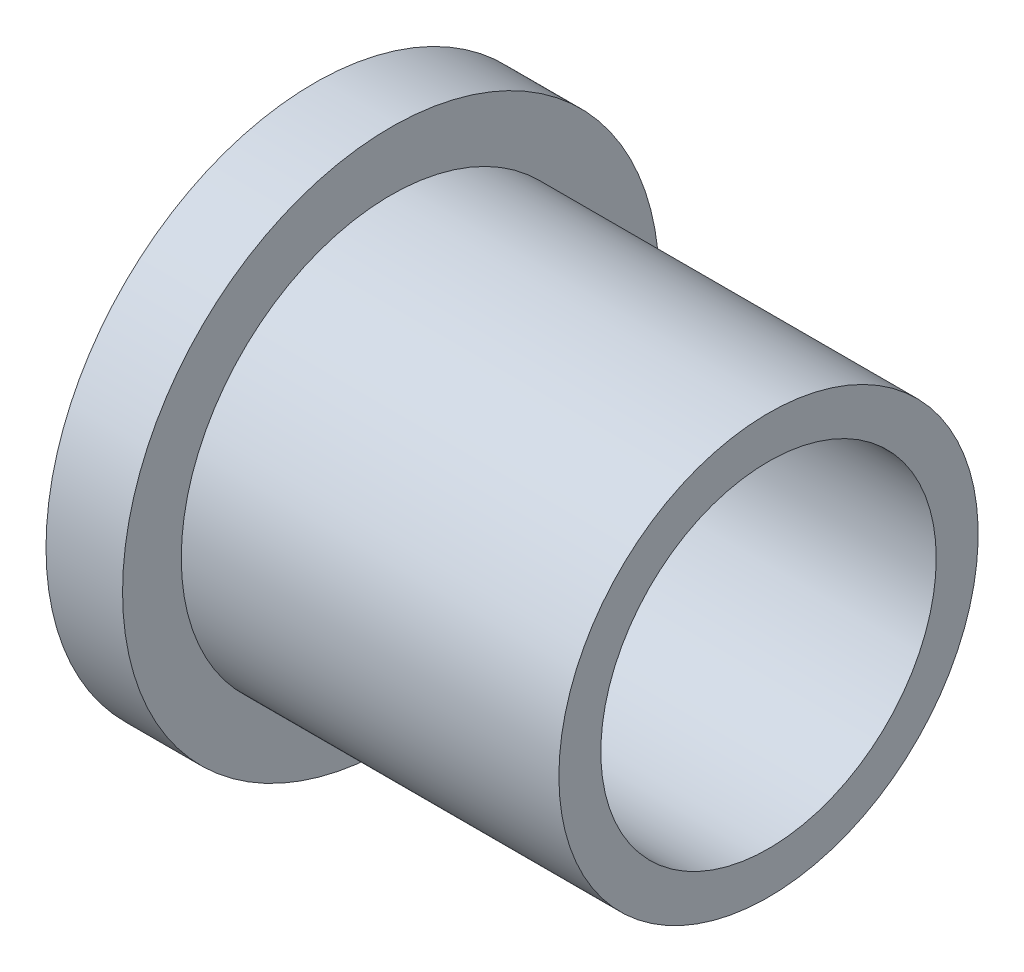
SolidWorks part; units mm, degrees
ref_plane "Front Plane" through (0, 0, 0) normal (0, 0, 1) x (1, 0, 0)
ref_plane "Top Plane" through (0, 0, 0) normal (0, 1, 0) x (1, 0, 0)
ref_plane "Right Plane" through (0, 0, 0) normal (1, 0, 0) x (0, 0, -1)
sketch "Sketch1" plane through (0, 0, 0) normal (0, 0, 1) x (1, 0, 0)
  line L0 (-46.6574, 0) -> (33.5772, 0) construction
  line L10 (-10.0605, 12.5) -> (12.4547, 12.5)
  line L12 (-10.0605, 0) -> (12.4547, 0)
  line L13 (12.4547, 12.5) -> (12.4547, 0)
  line L14 (-14.6255, 16) -> (-10.0605, 16)
  line L15 (-14.6255, 16) -> (-14.6255, 0)
  line L16 (-14.6255, 0) -> (-10.0605, 0)
  line L17 (-10.0605, 16) -> (-10.0605, 12.5)
  dimension "D1" = 16
  dimension "D2" = 12.5
revolve "Revolve1" add sketch "Sketch1" angle 360 about L0
sketch "Sketch2" plane through (12.4547, 0, 0) normal (1, 0, 0) x (0, 0, -1)
  circle A0 centre (0, 0) radius 10
  dimension "D1" = 20
extrude "Cut-Extrude1" cut sketch "Sketch2" against normal through all
